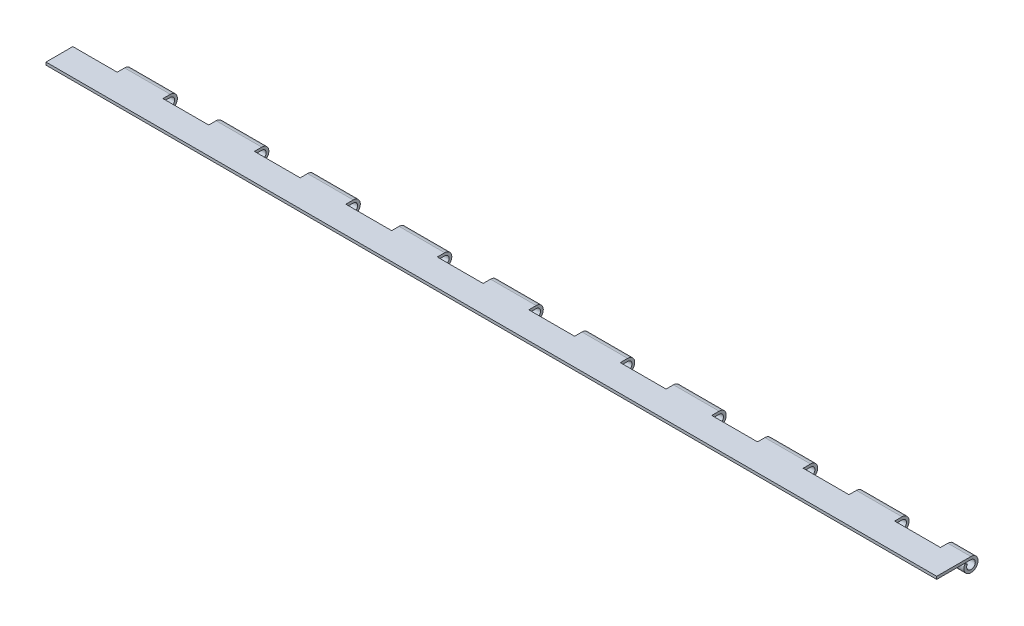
SolidWorks part; units mm, degrees
ref_plane "Front" through (0, 0, 0) normal (0, 0, 1) x (1, 0, 0)
ref_plane "Top" through (0, 0, 0) normal (0, 1, 0) x (1, 0, 0)
ref_plane "Right" through (0, 0, 0) normal (1, 0, 0) x (0, 0, -1)
sketch "Sketch1" plane through (0, 0, 0) normal (1, 0, 0) x (0, 0, -1)
  line L0 (-4.0946, 2.4711) -> (-6.7042, 4.046)
  line L1 (-6.2004, 4.7825) -> (0, 4.7825)
  line L2 (0, 7.8305) -> (-38.1, 7.8305)
  line L3 (-6.2004, 4.7825) -> (-38.1, 4.7825)
  line L4 (-38.1, 4.7825) -> (-38.1, 7.8305)
  arc A1 (-4.0946, 2.4711) -> (0, 4.7825) centre (0, 0) ccw
  arc A2 (-6.7042, 4.046) -> (0, 7.8305) centre (0, 0) ccw
  dimension "D1" = 9.565
  dimension "D2" = 38.1
extrude "Extrude1" add sketch "Sketch1" along normal blind 1219.2
sketch "Sketch2" plane through (0, 7.8305, 0) normal (0, 1, 0) x (1, 0, 0)
  line L0 (1219.2, -7.8305) -> (1219.2, 7.8305) construction
  line L1 (1168.4, 16.1474) -> (1117.473, 16.1474)
  line L2 (1168.4, 16.1474) -> (1168.4, -8.2787)
  line L3 (1168.4, -8.2787) -> (1117.473, -8.2787)
  line L4 (1117.473, 16.1474) -> (1117.473, -8.2787)
  line L5 (1219.2, 7.8305) -> (0, 7.8305) construction
  line L6 (1066.673, 16.1474) -> (1015.746, 16.1474)
  line L7 (1066.673, 16.1474) -> (1066.673, -8.2787)
  line L8 (1066.673, -8.2787) -> (1015.746, -8.2787)
  line L9 (1015.746, 16.1474) -> (1015.746, -8.2787)
  line L10 (964.946, 16.1474) -> (914.019, 16.1474)
  line L11 (964.946, 16.1474) -> (964.946, -8.2787)
  line L12 (964.946, -8.2787) -> (914.019, -8.2787)
  line L13 (914.019, 16.1474) -> (914.019, -8.2787)
  line L14 (863.219, 16.1474) -> (812.292, 16.1474)
  line L15 (863.219, 16.1474) -> (863.219, -8.2787)
  line L16 (863.219, -8.2787) -> (812.292, -8.2787)
  line L17 (812.292, 16.1474) -> (812.292, -8.2787)
  line L18 (761.492, 16.1474) -> (710.565, 16.1474)
  line L19 (761.492, 16.1474) -> (761.492, -8.2787)
  line L20 (761.492, -8.2787) -> (710.565, -8.2787)
  line L21 (710.565, 16.1474) -> (710.565, -8.2787)
  line L22 (659.765, 16.1474) -> (608.838, 16.1474)
  line L23 (659.765, 16.1474) -> (659.765, -8.2787)
  line L24 (659.765, -8.2787) -> (608.838, -8.2787)
  line L25 (608.838, 16.1474) -> (608.838, -8.2787)
  line L26 (558.038, 16.1474) -> (507.111, 16.1474)
  line L27 (558.038, 16.1474) -> (558.038, -8.2787)
  line L28 (558.038, -8.2787) -> (507.111, -8.2787)
  line L29 (507.111, 16.1474) -> (507.111, -8.2787)
  line L30 (456.311, 16.1474) -> (405.384, 16.1474)
  line L31 (456.311, 16.1474) -> (456.311, -8.2787)
  line L32 (456.311, -8.2787) -> (405.384, -8.2787)
  line L33 (405.384, 16.1474) -> (405.384, -8.2787)
  line L34 (354.584, 16.1474) -> (303.657, 16.1474)
  line L35 (354.584, 16.1474) -> (354.584, -8.2787)
  line L36 (354.584, -8.2787) -> (303.657, -8.2787)
  line L37 (303.657, 16.1474) -> (303.657, -8.2787)
  line L38 (252.857, 16.1474) -> (201.93, 16.1474)
  line L39 (252.857, 16.1474) -> (252.857, -8.2787)
  line L40 (252.857, -8.2787) -> (201.93, -8.2787)
  line L41 (201.93, 16.1474) -> (201.93, -8.2787)
  line L42 (151.13, 16.1474) -> (100.203, 16.1474)
  line L43 (151.13, 16.1474) -> (151.13, -8.2787)
  line L44 (151.13, -8.2787) -> (100.203, -8.2787)
  line L45 (100.203, 16.1474) -> (100.203, -8.2787)
  line L46 (49.403, 16.1474) -> (-1.524, 16.1474)
  line L47 (49.403, 16.1474) -> (49.403, -8.2787)
  line L48 (49.403, -8.2787) -> (-1.524, -8.2787)
  line L49 (-1.524, 16.1474) -> (-1.524, -8.2787)
  point P7 (1219.2, 7.8305)
  point P8 (1117.473, 7.8305)
  point P16 (1117.473, 7.8305)
  point P17 (1117.473, 7.8305)
  point P18 (1015.746, 7.8305)
  point P19 (1015.746, 7.8305)
  point P24 (1015.746, 7.8305)
  point P25 (914.019, 7.8305)
  point P30 (914.019, 7.8305)
  point P31 (914.019, 7.8305)
  point P32 (812.292, 7.8305)
  point P33 (812.292, 7.8305)
  point P38 (812.292, 7.8305)
  point P39 (710.565, 7.8305)
  point P44 (710.565, 7.8305)
  point P45 (710.565, 7.8305)
  point P46 (608.838, 7.8305)
  point P47 (608.838, 7.8305)
  point P52 (608.838, 7.8305)
  point P53 (507.111, 7.8305)
  point P58 (507.111, 7.8305)
  point P59 (507.111, 7.8305)
  point P60 (405.384, 7.8305)
  point P61 (405.384, 7.8305)
  point P66 (405.384, 7.8305)
  point P67 (303.657, 7.8305)
  point P72 (303.657, 7.8305)
  point P73 (303.657, 7.8305)
  point P74 (201.93, 7.8305)
  point P75 (201.93, 7.8305)
  point P80 (201.93, 7.8305)
  point P81 (100.203, 7.8305)
  point P86 (100.203, 7.8305)
  point P87 (100.203, 7.8305)
  point P88 (-1.524, 7.8305)
  point P89 (-1.524, 7.8305)
  point P94 (-1.524, 7.8305)
  dimension "D1" = 50.8
  dimension "D2" = 50.927
extrude "Cut-Extrude1" cut sketch "Sketch2" against normal through all
sketch "Sketch3" plane through (0, 7.8305, 0) normal (0, 1, 0) x (1, 0, 0)
  line L1 (1241.3956, 35.9637) -> (990.6, 35.9637)
  line L2 (1241.3956, 35.9637) -> (1241.3956, -77.9128)
  line L3 (1241.3956, -77.9128) -> (990.6, -77.9128)
  line L4 (990.6, 35.9637) -> (990.6, -77.9128)
  line L5 (0, -8.2787) -> (0, -38.1) construction
  dimension "D1" = 990.6
extrude "Cut-Extrude2" cut sketch "Sketch3" against normal through all
